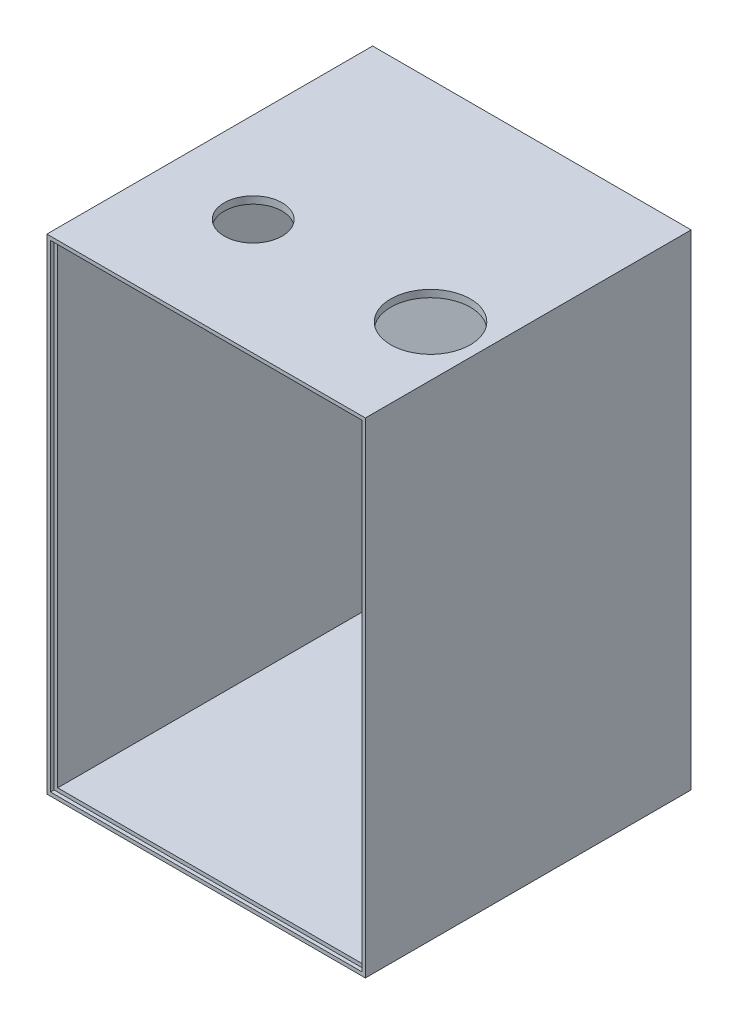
SolidWorks part; units mm, degrees
ref_plane "Ebene vorne" through (0, 0, 0) normal (0, 0, 1) x (1, 0, 0)
ref_plane "Ebene oben" through (0, 0, 0) normal (0, 1, 0) x (1, 0, 0)
ref_plane "Ebene rechts" through (0, 0, 0) normal (1, 0, 0) x (0, 0, -1)
sketch "Skizze1" plane through (0, 0, 0) normal (0, 0, 1) x (1, 0, 0)
  line L1 (-44, -67) -> (44, -67)
  line L2 (-44, -67) -> (-44, 67)
  line L3 (-44, 67) -> (44, 67)
  line L4 (44, -67) -> (44, 67)
  line L5 (-44, -67) -> (44, 67) construction
  line L6 (-44, 67) -> (44, -67) construction
  point P0 (0, 0)
  dimension "D1" = 88
  dimension "D2" = 134
extrude "Aufsatz-Linear austragen1" add sketch "Skizze1" along normal blind 2
sketch "Skizze2" plane through (0, 0, 2) normal (0, 0, 1) x (1, 0, 0)
  line L1 (-44, -67) -> (44, -67)
  line L2 (-44, -67) -> (-44, 67)
  line L3 (-44, 67) -> (44, 67)
  line L4 (44, -67) -> (44, 67)
  line L5 (-44, -67) -> (44, 67) construction
  line L6 (-44, 67) -> (44, -67) construction
  line L7 (-42, -65) -> (42, -65)
  line L8 (-42, -65) -> (-42, 65)
  line L9 (-42, 65) -> (42, 65)
  line L10 (42, -65) -> (42, 65)
  line L11 (-42, -65) -> (42, 65) construction
  line L12 (-42, 65) -> (42, -65) construction
  point P0 (0, 0)
  point P7 (0, 0)
  dimension "D1" = 2
  dimension "D2" = 2
extrude "Aufsatz-Linear austragen2" add sketch "Skizze2" along normal blind 88 contours L2 L1 L4 L3 | L8 L7 L10 L9
sketch "Skizze3" plane through (0, 0, 90) normal (0, 0, 1) x (1, 0, 0)
  line L0 (44, -67) -> (44, 67) construction
  line L1 (-43, -66) -> (43, -66)
  line L2 (-43, -66) -> (-43, 66)
  line L3 (-43, 66) -> (43, 66)
  line L4 (43, -66) -> (43, 66)
  line L5 (-43, -66) -> (43, 66) construction
  line L6 (-43, 66) -> (43, -66) construction
  line L7 (-44, 67) -> (44, 67) construction
  point P0 (0, 0)
  dimension "D1" = 1
  dimension "D2" = 1
extrude "Schnitt-Linear austragen1" cut sketch "Skizze3" against normal blind 1
sketch "Skizze4" plane through (0, 67, 0) normal (0, 1, 0) x (1, 0, 0)
  line L0 (-44, -58) -> (44, -58) construction
  line L1 (-44, -90) -> (-44, 0) construction
  line L2 (44, -90) -> (44, 0) construction
  line L3 (-44, -90) -> (44, -90) construction
  circle A0 centre (30, -58) radius 11
  circle A1 centre (-19, -58) radius 8
  dimension "D2" = 22
  dimension "D5" = 16
  dimension "D1" = 14
  dimension "D3" = 32
  dimension "D4" = 25
extrude "Schnitt-Linear austragen2" cut sketch "Skizze4" against normal blind 11
